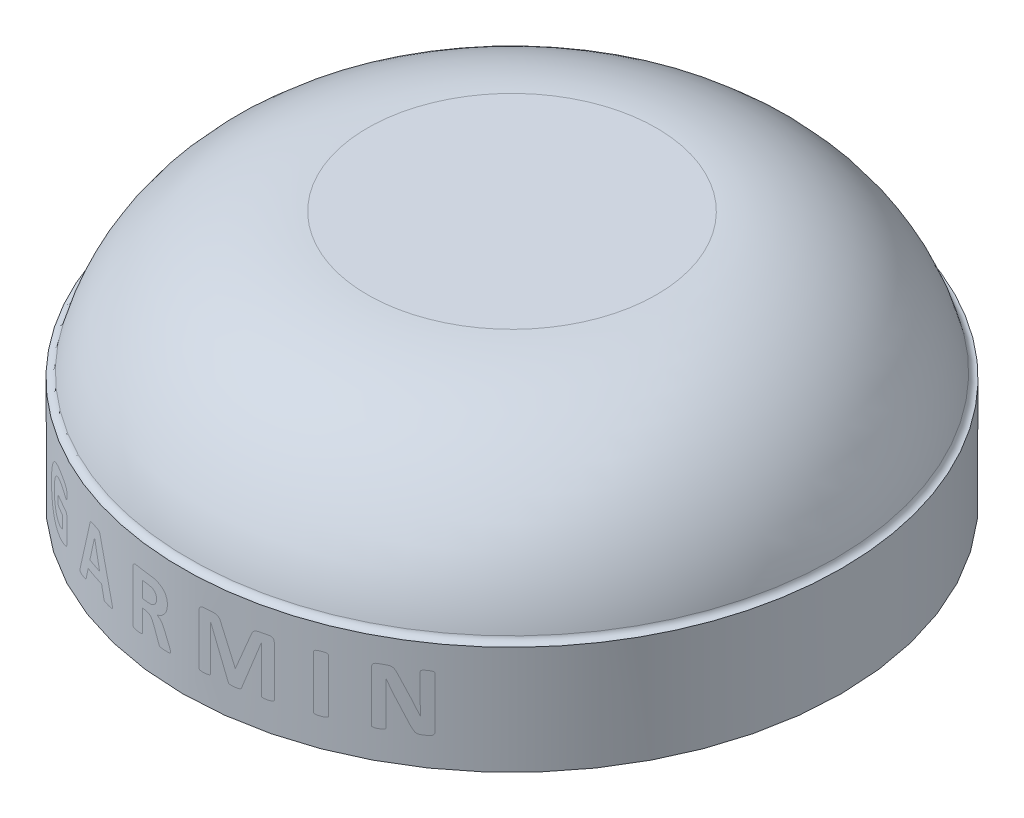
SolidWorks part; units mm, degrees
ref_plane "Alzado" through (0, 0, 0) normal (0, 0, 1) x (1, 0, 0)
ref_plane "Planta" through (0, 0, 0) normal (0, 1, 0) x (1, 0, 0)
ref_plane "Vista lateral" through (0, 0, 0) normal (1, 0, 0) x (0, 0, -1)
sketch "Croquis1" plane through (0, 0, 0) normal (0, 0, 1) x (1, 0, 0)
  line L0 (0, -17.5) -> (0, 17.5)
  line L1 (0, -17.5) -> (45.62, -17.5)
  line L2 (45.62, -17.5) -> (45.62, -2.5)
  line L3 (0, 17.5) -> (20, 17.5)
  line L4 (45.62, -2.5) -> (44.87, -2.5)
  arc A1 (20, 17.5) -> (44.87, -2.5) centre (20, -7.9629) cw
  point P7 (0, 0)
  dimension "D4" = 25.4629
  dimension "D1" = 35
  dimension "D2" = 45.62
  dimension "D3" = 20
  dimension "D5" = 0.75
revolve "Revolución1" add sketch "Croquis1" angle 360 about L0
fillet "Redondeo1" radius 0.95 1 edges at (44.87, -2.5, 0)
shell "Vaciado1" thickness 3
thread "Rosca1" pitch 1.5 start angle 0, offset 0, length 0, pitch 1.5, diameter 85.24
ref_plane "Plano1" through (42.62, -17.5, 0) normal (0, 0, 1) x (1, 0, 0)
sketch "Perfil de rosca1" plane through (42.62, -17.5, 0) normal (0, 0, 1) x (1, 0, 0)
  line L0 (0, 0) -> (0, 1.5) construction
  line L11 (0, 0) -> (0, 1.3125)
  line L12 (0, 1.3125) -> (-0.8119, 0.8437)
  line L13 (-0.8119, 0.8437) -> (-0.8119, 0.4687)
  line L15 (-0.8119, 0.4687) -> (0, 0)
  line L17 (-0.8119, 0.6562) -> (0, 0.6562) construction
  point P2 (0, 0)
  dimension "Pitch" = 1.5
  dimension "Profile_Angle" = 60
  dimension "Profile_Land" = 0.375
  dimension "Profile_Height" = 0.8119
ref_plane "Plano2" through (0, 0, 47) normal (0, 0, 1) x (1, 0, 0)
sketch "Croquis5" plane through (0, 0, 47) normal (0, 0, 1) x (1, 0, 0)
  line L0 (-45, -13.6) -> (45, -13.6) construction
  line L2 (-45.62, -17.5) -> (45.62, -17.5) construction
  text T0 "G A R M I N" font "Calibri" height 7.8
  point P4 (0, -13.6)
  dimension "D1" = 3.9
  dimension "D2" = 90
wrap "Envolver1" sketch "Croquis5" wrap type scribe source sketch "Croquis5"
